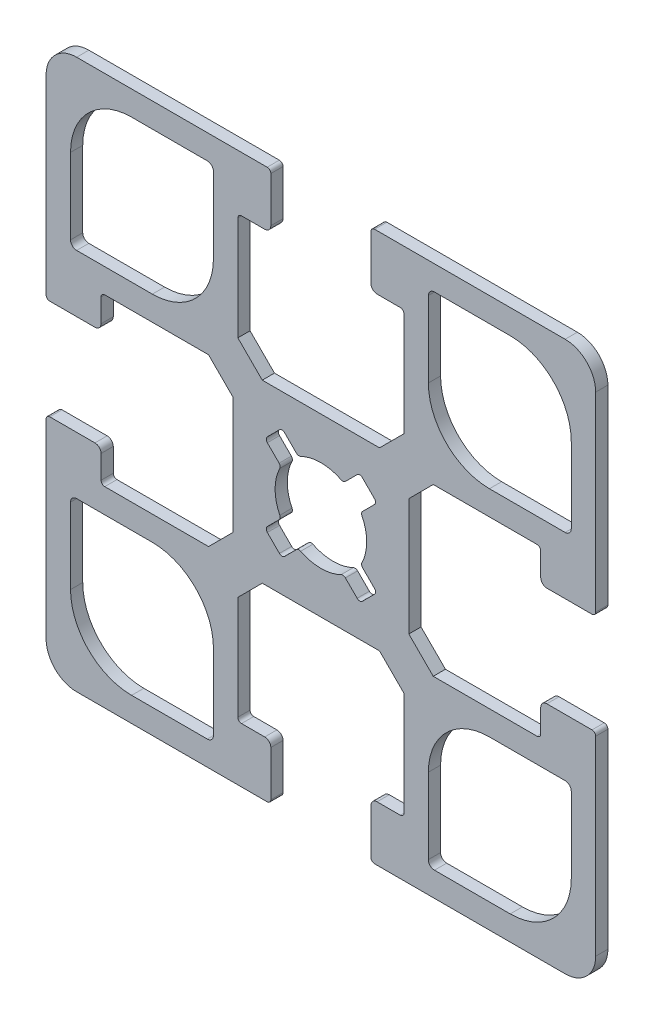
SolidWorks part; units mm, degrees
ref_plane "Ebene vorne" through (0, 0, 0) normal (0, 0, 1) x (1, 0, 0)
ref_plane "Ebene oben" through (0, 0, 0) normal (0, 1, 0) x (1, 0, 0)
ref_plane "Ebene rechts" through (0, 0, 0) normal (1, 0, 0) x (0, 0, -1)
sketch "Model" plane through (0, 0, 0) normal (0, 0, 1) x (1, 0, 0)
  line L0 (9.2, -6.8) -> (7.2, -4.8)
  line L1 (2.9698, -4.3841) -> (2.0051, -3.4193)
  line L2 (-3.3941, -4.3841) -> (-4.3841, -3.3941)
  line L3 (4.3841, -2.9698) -> (3.4193, -2.0051)
  line L4 (-3.4193, 2.0051) -> (-4.3841, 2.9698)
  line L5 (4.3841, 3.3941) -> (3.3941, 4.3841)
  line L6 (-2.0051, 3.4193) -> (-2.9698, 4.3841)
  line L7 (-7.2, 4.8) -> (-9.2, 6.8)
  line L8 (6.8, -9.2) -> (4.8, -7.2)
  line L9 (-4.8, 7.2) -> (-6.8, 9.2)
  line L10 (-20, -22.5) -> (-4.4, -22.5)
  line L11 (4.4, -22.5) -> (20, -22.5)
  line L12 (-15.5, -20.5) -> (-9.3, -20.5)
  line L13 (9.3, -20.5) -> (15.5, -20.5)
  line L14 (-6.5, -18) -> (-4.6, -18)
  line L15 (4.6, -18) -> (6.5, -18)
  line L16 (-20, -8.8) -> (-13.8, -8.8)
  line L17 (13.8, -8.8) -> (20, -8.8)
  line L18 (-4.8, -7.2) -> (4.8, -7.2)
  line L19 (-17.7, -6.8) -> (-9.2, -6.8)
  line L20 (9.2, -6.8) -> (17.7, -6.8)
  line L21 (-22.2, -4.1) -> (-18.5, -4.1)
  line L22 (18.5, -4.1) -> (22.2, -4.1)
  line L23 (-22.2, 4.1) -> (-18.5, 4.1)
  line L24 (18.5, 4.1) -> (22.2, 4.1)
  line L25 (-17.7, 6.8) -> (-9.2, 6.8)
  line L26 (9.2, 6.8) -> (17.7, 6.8)
  line L27 (-4.8, 7.2) -> (4.8, 7.2)
  line L28 (13.8, 8.8) -> (20, 8.8)
  line L29 (-20, 8.8) -> (-13.8, 8.8)
  line L30 (4.6, 18) -> (6.5, 18)
  line L31 (-6.5, 18) -> (-4.6, 18)
  line L32 (9.3, 20.5) -> (15.5, 20.5)
  line L33 (-15.5, 20.5) -> (-9.3, 20.5)
  line L34 (4.4, 22.5) -> (20, 22.5)
  line L35 (-20, 22.5) -> (-4.4, 22.5)
  line L36 (-6.8, -9.2) -> (-4.8, -7.2)
  line L37 (-9.2, -6.8) -> (-7.2, -4.8)
  line L38 (3.3941, -4.3841) -> (4.3841, -3.3941)
  line L39 (-4.3841, -2.9698) -> (-3.4193, -2.0051)
  line L40 (3.4193, 2.0051) -> (4.3841, 2.9698)
  line L41 (-2.9698, -4.3841) -> (-2.0051, -3.4193)
  line L42 (-4.3841, 3.3941) -> (-3.3941, 4.3841)
  line L43 (2.0051, 3.4193) -> (2.9698, 4.3841)
  line L44 (7.2, 4.8) -> (9.2, 6.8)
  line L45 (4.8, 7.2) -> (6.8, 9.2)
  line L46 (-22.5, 4.4) -> (-22.5, 20)
  line L47 (-22.5, -20) -> (-22.5, -4.4)
  line L48 (-20.5, -15.5) -> (-20.5, -9.3)
  line L49 (-20.5, 9.3) -> (-20.5, 15.5)
  line L50 (-18, 4.6) -> (-18, 6.5)
  line L51 (-18, -6.5) -> (-18, -4.6)
  line L52 (-8.8, -20) -> (-8.8, -13.8)
  line L53 (-8.8, 13.8) -> (-8.8, 20)
  line L54 (-7.2, -4.8) -> (-7.2, 4.8)
  line L55 (-6.8, -17.7) -> (-6.8, -9.2)
  line L56 (-6.8, 9.2) -> (-6.8, 17.7)
  line L57 (-4.1, -22.2) -> (-4.1, -18.5)
  line L58 (-4.1, 18.5) -> (-4.1, 22.2)
  line L59 (4.1, -22.2) -> (4.1, -18.5)
  line L60 (4.1, 18.5) -> (4.1, 22.2)
  line L61 (6.8, -17.7) -> (6.8, -9.2)
  line L62 (6.8, 9.2) -> (6.8, 17.7)
  line L63 (7.2, -4.8) -> (7.2, 4.8)
  line L64 (8.8, -20) -> (8.8, -13.8)
  line L65 (8.8, 13.8) -> (8.8, 20)
  line L66 (18, -6.5) -> (18, -4.6)
  line L67 (18, 4.6) -> (18, 6.5)
  line L68 (20.5, -15.5) -> (20.5, -9.3)
  line L69 (20.5, 9.3) -> (20.5, 15.5)
  line L70 (22.5, -20) -> (22.5, -4.4)
  line L71 (22.5, 4.4) -> (22.5, 20)
  arc A0 (-22.2, -4.1) -> (-22.5, -4.4) centre (-22.2, -4.4) ccw
  arc A1 (-22.5, 4.4) -> (-22.2, 4.1) centre (-22.2, 4.4) ccw
  arc A2 (-22.5, -20) -> (-20, -22.5) centre (-20, -20) ccw
  arc A3 (-20, -8.8) -> (-20.5, -9.3) centre (-20, -9.3) ccw
  arc A4 (-20.5, 9.3) -> (-20, 8.8) centre (-20, 9.3) ccw
  arc A5 (-20, 22.5) -> (-22.5, 20) centre (-20, 20) ccw
  arc A6 (-18, -4.6) -> (-18.5, -4.1) centre (-18.5, -4.6) ccw
  arc A7 (-18.5, 4.1) -> (-18, 4.6) centre (-18.5, 4.6) ccw
  arc A8 (-18, -6.5) -> (-17.7, -6.8) centre (-17.7, -6.5) ccw
  arc A9 (-17.7, 6.8) -> (-18, 6.5) centre (-17.7, 6.5) ccw
  arc A10 (-20.5, -15.5) -> (-15.5, -20.5) centre (-15.5, -15.5) ccw
  arc A11 (-15.5, 20.5) -> (-20.5, 15.5) centre (-15.5, 15.5) ccw
  arc A12 (-8.8, -13.8) -> (-13.8, -8.8) centre (-13.8, -13.8) ccw
  arc A13 (-13.8, 8.8) -> (-8.8, 13.8) centre (-13.8, 13.8) ccw
  arc A14 (-9.3, -20.5) -> (-8.8, -20) centre (-9.3, -20) ccw
  arc A15 (-8.8, 20) -> (-9.3, 20.5) centre (-9.3, 20) ccw
  arc A16 (-6.8, -17.7) -> (-6.5, -18) centre (-6.5, -17.7) ccw
  arc A17 (-6.5, 18) -> (-6.8, 17.7) centre (-6.5, 17.7) ccw
  arc A18 (-4.1, -18.5) -> (-4.6, -18) centre (-4.6, -18.5) ccw
  arc A19 (-4.6, 18) -> (-4.1, 18.5) centre (-4.6, 18.5) ccw
  arc A20 (-4.4, -22.5) -> (-4.1, -22.2) centre (-4.4, -22.2) ccw
  arc A21 (-4.1, 22.2) -> (-4.4, 22.5) centre (-4.4, 22.2) ccw
  arc A22 (-4.3841, -2.9698) -> (-4.3841, -3.3941) centre (-4.1719, -3.182) ccw
  arc A23 (-4.3841, 3.3941) -> (-4.3841, 2.9698) centre (-4.1719, 3.182) ccw
  arc A24 (-3.4193, -2.0051) -> (-3.3625, -1.6602) centre (-3.6315, -1.793) ccw
  arc A25 (-3.3625, 1.6602) -> (-3.4193, 2.0051) centre (-3.6315, 1.793) ccw
  arc A26 (-3.3941, -4.3841) -> (-2.9698, -4.3841) centre (-3.182, -4.1719) ccw
  arc A27 (-2.9698, 4.3841) -> (-3.3941, 4.3841) centre (-3.182, 4.1719) ccw
  arc A28 (-1.6602, -3.3625) -> (-2.0051, -3.4193) centre (-1.793, -3.6315) ccw
  arc A29 (-2.0051, 3.4193) -> (-1.6602, 3.3625) centre (-1.793, 3.6315) ccw
  arc A30 (1.6602, 3.3625) -> (-1.6602, 3.3625) centre (0, 0) ccw
  arc A31 (3.3625, -1.6602) -> (3.3625, 1.6602) centre (0, 0) ccw
  arc A32 (-1.6602, -3.3625) -> (1.6602, -3.3625) centre (0, 0) ccw
  arc A33 (-3.3625, 1.6602) -> (-3.3625, -1.6602) centre (0, 0) ccw
  arc A34 (2.0051, -3.4193) -> (1.6602, -3.3625) centre (1.793, -3.6315) ccw
  arc A35 (1.6602, 3.3625) -> (2.0051, 3.4193) centre (1.793, 3.6315) ccw
  arc A36 (2.9698, -4.3841) -> (3.3941, -4.3841) centre (3.182, -4.1719) ccw
  arc A37 (3.3941, 4.3841) -> (2.9698, 4.3841) centre (3.182, 4.1719) ccw
  arc A38 (3.3625, -1.6602) -> (3.4193, -2.0051) centre (3.6315, -1.793) ccw
  arc A39 (3.4193, 2.0051) -> (3.3625, 1.6602) centre (3.6315, 1.793) ccw
  arc A40 (4.3841, -3.3941) -> (4.3841, -2.9698) centre (4.1719, -3.182) ccw
  arc A41 (4.3841, 2.9698) -> (4.3841, 3.3941) centre (4.1719, 3.182) ccw
  arc A42 (4.1, -22.2) -> (4.4, -22.5) centre (4.4, -22.2) ccw
  arc A43 (4.4, 22.5) -> (4.1, 22.2) centre (4.4, 22.2) ccw
  arc A44 (4.6, -18) -> (4.1, -18.5) centre (4.6, -18.5) ccw
  arc A45 (4.1, 18.5) -> (4.6, 18) centre (4.6, 18.5) ccw
  arc A46 (6.5, -18) -> (6.8, -17.7) centre (6.5, -17.7) ccw
  arc A47 (6.8, 17.7) -> (6.5, 18) centre (6.5, 17.7) ccw
  arc A48 (8.8, -20) -> (9.3, -20.5) centre (9.3, -20) ccw
  arc A49 (9.3, 20.5) -> (8.8, 20) centre (9.3, 20) ccw
  arc A50 (13.8, -8.8) -> (8.8, -13.8) centre (13.8, -13.8) ccw
  arc A51 (8.8, 13.8) -> (13.8, 8.8) centre (13.8, 13.8) ccw
  arc A52 (15.5, -20.5) -> (20.5, -15.5) centre (15.5, -15.5) ccw
  arc A53 (20.5, 15.5) -> (15.5, 20.5) centre (15.5, 15.5) ccw
  arc A54 (17.7, -6.8) -> (18, -6.5) centre (17.7, -6.5) ccw
  arc A55 (18, 6.5) -> (17.7, 6.8) centre (17.7, 6.5) ccw
  arc A56 (18.5, -4.1) -> (18, -4.6) centre (18.5, -4.6) ccw
  arc A57 (18, 4.6) -> (18.5, 4.1) centre (18.5, 4.6) ccw
  arc A58 (20, -22.5) -> (22.5, -20) centre (20, -20) ccw
  arc A59 (20.5, -9.3) -> (20, -8.8) centre (20, -9.3) ccw
  arc A60 (20, 8.8) -> (20.5, 9.3) centre (20, 9.3) ccw
  arc A61 (22.5, 20) -> (20, 22.5) centre (20, 20) ccw
  arc A62 (22.5, -4.4) -> (22.2, -4.1) centre (22.2, -4.4) ccw
  arc A63 (22.2, 4.1) -> (22.5, 4.4) centre (22.2, 4.4) ccw
extrude "Aufsatz-Linear austragen1" add sketch "Model" along normal mid plane 1
other "PropertyManager"
